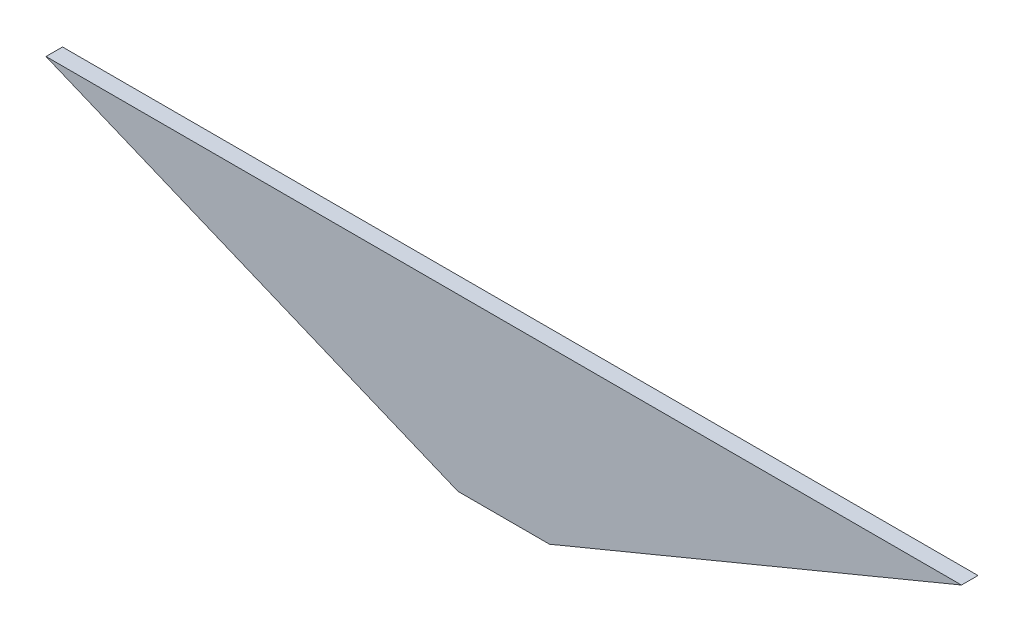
SolidWorks part; units mm, degrees
ref_plane "Plan de face" through (0, 0, 0) normal (0, 0, 1) x (1, 0, 0)
ref_plane "Plan de dessus" through (0, 0, 0) normal (0, 1, 0) x (1, 0, 0)
ref_plane "Plan de droite" through (0, 0, 0) normal (1, 0, 0) x (0, 0, -1)
sketch "Esquisse1" plane through (0, 0, 0) normal (0, 0, 1) x (1, 0, 0)
  line L0 (-138.582, 51.662) -> (138.582, 51.662)
  line L1 (-13.858, 0) -> (13.858, 0)
  line L2 (13.858, 0) -> (138.582, 51.662)
  line L3 (-13.858, 0) -> (-138.582, 51.662)
  point P2 (0, 51.662)
  point P6 (0, 0)
  dimension "D1" = 277.164
  dimension "D2" = 51.662
  dimension "D3" = 27.716
extrude "Boss.-Extru.1" add sketch "Esquisse1" along normal mid plane 5
